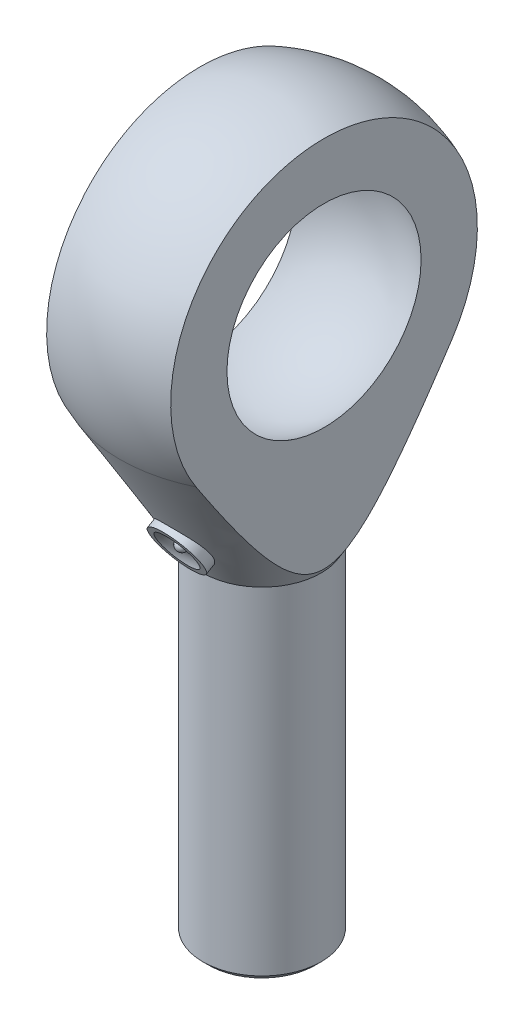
SolidWorks part; units mm, degrees
ref_plane "Plan1" through (0, 0, 0) normal (0, 0, 1) x (1, 0, 0)
ref_plane "Plan2" through (0, 0, 0) normal (0, 1, 0) x (1, 0, 0)
ref_plane "Plan3" through (0, 0, 0) normal (1, 0, 0) x (0, 0, -1)
sketch "Esquisse1" plane through (0, 0, 0) normal (0, 0, 1) x (1, 0, 0)
  line L0 (0, 30.475) -> (0, -68.4613) construction
  line L1 (-5, -48) -> (0, -48)
  line L2 (0, -48) -> (0, 14)
  line L3 (-5, -19) -> (-12.0377, -7.148)
  line L7 (-5, -19) -> (-5, -48)
  arc A0 (0, 14) -> (-12.0377, -7.148) centre (0, 0) ccw
  dimension "D1" = 28
  dimension "D4" = 48
  dimension "D2" = 5
revolve "Base-Révolution" add sketch "Esquisse1"
chamfer "Chanfrein1" distance 0.5 angle 45 1 edges at (0, -48, 5)
ref_plane "Plan4" through (5.25, 0, 0) normal (1, 0, 0) x (0, 0, -1)
sketch "Esquisse2" plane through (5.25, 0, 0) normal (1, 0, 0) x (0, 0, -1)
  line L0 (-15.597, 13.4918) -> (18.4267, 13.4918)
  line L1 (-15.597, 13.4918) -> (-15.597, -19.656)
  line L2 (18.4267, -19.656) -> (-15.597, -19.656)
  line L3 (18.4267, -19.656) -> (18.4267, 13.4918)
extrude "Enlèv. mat.-Extru.1" cut sketch "Esquisse2" along normal through all
mirror "Symétrie1" about plane through (0, 0, 0) normal (1, 0, 0) of "Enlèv. mat.-Extru.1"
sketch "Esquisse3" plane through (0, 0, 0) normal (1, 0, 0) x (0, 0, -1)
  line L0 (0, 14.3677) -> (0, -12.6491) construction
  line L1 (0, 30.475) -> (0, -68.4613) construction
  line L2 (0, 9.75) -> (0, -9.75)
  arc A0 (0, 9.75) -> (0, -9.75) centre (0, 0) ccw
  dimension "D1" = 19.5
revolve "Boss.-Révol.1" add sketch "Esquisse3" angle 360 about L0
ref_plane "Plan5" through (7, 0, 0) normal (1, 0, 0) x (0, 0, -1)
sketch "Esquisse4" plane through (7, 0, 0) normal (1, 0, 0) x (0, 0, -1)
  line L0 (-7.6816, 7.1587) -> (8.7575, 7.1587)
  line L1 (-7.6816, 7.1587) -> (-7.6816, -7.5287)
  line L2 (8.7575, -7.5287) -> (-7.6816, -7.5287)
  line L3 (8.7575, -7.5287) -> (8.7575, 7.1587)
extrude "Enlèv. mat.-Extru.2" cut sketch "Esquisse4" along normal through all
mirror "Symétrie2" about plane through (0, 0, 0) normal (1, 0, 0) of "Enlèv. mat.-Extru.2"
sketch "Esquisse5" plane through (-7, 0, 0) normal (-1, 0, 0) x (0, 0, 1)
  circle A0 centre (0, 0) radius 5
  dimension "D1" = 10
extrude "Enlèv. mat.-Extru.3" cut sketch "Esquisse5" against normal through all
sketch "Esquisse7" plane through (0, 0, 0) normal (1, 0, 0) x (0, 0, -1)
  line L0 (0, 9.75) -> (0, -9.75)
  line L1 (0, -9.75) -> (0, 9.75)
  line L2 (0, -9.75) -> (0, 9.75) construction
  arc A1 (0, 9.75) -> (0, -9.75) centre (0, 0) ccw
  arc A2 (0, 9.75) -> (0, -9.75) centre (0, 0) ccw
  dimension "D1" = 0
revolve "Enlèvement de matière-Révolution1" cut sketch "Esquisse7" angle 360 about L2
sketch "Esquisse6" plane through (0, 0, 0) normal (1, 0, 0) x (0, 0, -1)
  line L0 (-6.7696, -16.0198) -> (0, -12) construction
  line L1 (-12.0377, -7.148) -> (-5, -19) construction
  line L2 (-5.4799, -15.2539) -> (-6.6287, -13.3193)
  line L3 (-6.6287, -13.3193) -> (-8.3483, -14.3405)
  line L4 (-8.3483, -14.3405) -> (-8.0931, -14.7704)
  line L5 (-5.4799, -15.2539) -> (-7.1996, -16.2751)
  arc A0 (-7.1996, -16.2751) -> (-7.1756, -15.7279) centre (-6.7696, -16.0198) cw
  arc A1 (-8.0931, -14.7704) -> (-7.1756, -15.7279) centre (-8.9967, -16.5546) cw
  dimension "D4" = 0.5
  dimension "D7" = 2
  dimension "D1" = 12
  dimension "D2" = 1.5
  dimension "D3" = 0.5
  dimension "D5" = 4.5
  dimension "D6" = 3.5
  dimension "D8" = 0.3
revolve "Boss.-Révol.2" add sketch "Esquisse6" angle 360 about L0
